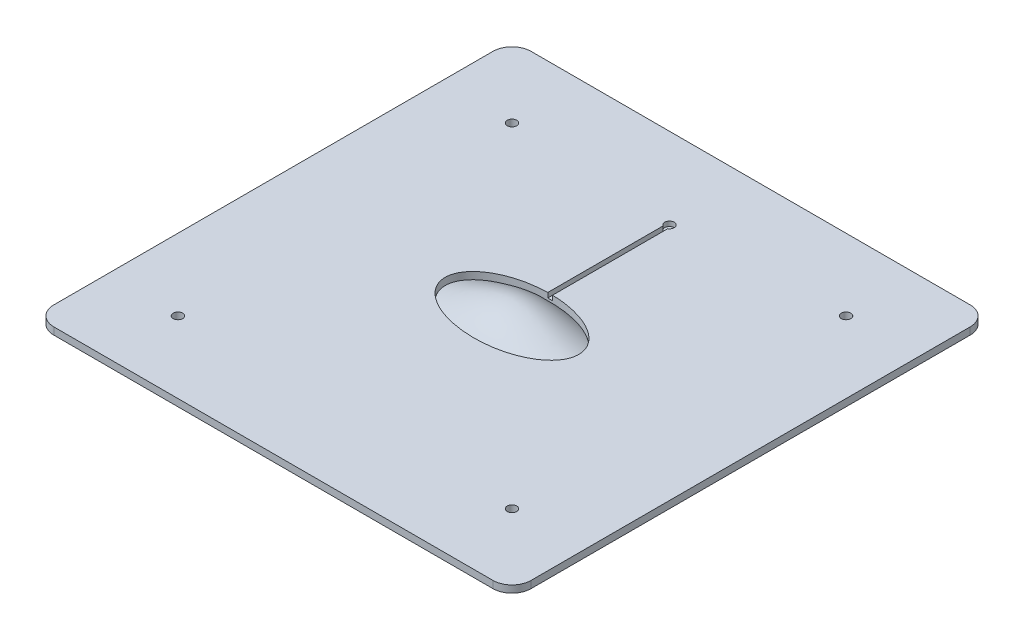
SolidWorks part; units mm, degrees
ref_plane "前视基准面" through (0, 0, 0) normal (0, 0, 1) x (1, 0, 0)
ref_plane "上视基准面" through (0, 0, 0) normal (0, 1, 0) x (1, 0, 0)
ref_plane "右视基准面" through (0, 0, 0) normal (1, 0, 0) x (0, 0, -1)
other "Configuration Table"
sketch "草图1" plane through (0, 0, 0) normal (0, 1, 0) x (1, 0, 0)
  line L1 (46, -50) -> (-46, -50)
  line L2 (50, -46) -> (50, 46)
  line L3 (46, 50) -> (-46, 50)
  line L4 (-50, -46) -> (-50, 46)
  line L5 (50, -50) -> (-50, 50) construction
  line L6 (50, 50) -> (-50, -50) construction
  arc A0 (-46, -50) -> (-50, -46) centre (-46, -46) cw
  arc A1 (46, -50) -> (50, -46) centre (46, -46) ccw
  arc A2 (46, 50) -> (50, 46) centre (46, 46) cw
  arc A3 (-50, 46) -> (-46, 50) centre (-46, 46) cw
  point P0 (0, 0)
  dimension "D3" = 4
  dimension "D1" = 100
  dimension "D2" = 100
extrude "凸台-拉伸1" add sketch "草图1" along normal blind 1.5
sketch "草图2" plane through (0, 1.5, 0) normal (0, 1, 0) x (1, 0, 0)
  ellipse E0 centre (0, 0) end of major axis (-14, 0) minor radius 8
  dimension "D1" = 28
  dimension "D2" = 16
extrude "切除-拉伸2" cut sketch "草图2" against normal blind 10
sketch "草图4" plane through (0, 0, 0) normal (0, -1, 0) x (1, 0, 0)
  line L0 (-14, 0) -> (14, 0) construction
  ellipse E0 centre (0, 0) end of major axis (-14, 0) minor radius 8 construction
  ellipse E1 centre (0, 0) end of major axis (-14, 0) minor radius 8 (14, 0) -> (-14, 0) ccw
  point P0 (-14, 0)
  point P1 (14, 0)
  point P9 (-14, 0)
  point P15 (14, 0)
sketch "草图5" plane through (0, 0, 0) normal (0, -1, 0) x (1, 0, 0)
  line L0 (-14, 0) -> (14, 0) construction
  line L1 (-14, 0) -> (14, 0) construction
  ellipse E0 centre (0, 0) end of major axis (-14, 0) minor radius 8 (-14, 0) -> (14, 0) ccw
sketch "草图6" plane through (0, 0, 0) normal (1, 0, 0) x (0, 0, -1)
  line L0 (-8, 0) -> (0, 0) construction
  spline S0 degree 2 poles (-8, 0) (0, 8.7188) (8, 0) knots 0 0 0 1 1 1
  point P2 (0, 4.3594)
surface "曲面-放样1"
sketch "草图7" plane through (0, 1.5, 0) normal (0, 1, 0) x (1, 0, 0)
  line L0 (0, 11.2203) -> (0, 33)
  line L1 (-6.6765, 11.2203) -> (9.1079, 11.2203) construction
  line L2 (46, 50) -> (-46, 50) construction
  dimension "D1" = 17
extrude "切除-拉伸-薄壁2" cut sketch "草图7" against normal blind 1 thin
sketch "草图9" plane through (0, 1.5, 0) normal (0, 1, 0) x (1, 0, 0)
  line L0 (-0.5, 11.2203) -> (0.5, 11.2203)
  line L1 (-0.5, 11.2203) -> (-0.5, 6.7293)
  line L2 (0.5, 11.2203) -> (0.5, 6.7293)
  line L3 (-0.5, 6.7293) -> (0.5, 6.7293)
  line L4 (-0.5, 11.2203) -> (-0.5, 33) construction
extrude "切除-拉伸3" cut sketch "草图9" against normal blind 1
sketch "草图10" plane through (0, 1.5, 0) normal (0, 1, 0) x (1, 0, 0)
  line L0 (-0.5, 33) -> (0.5, 33) construction
  line L1 (46, 50) -> (-46, 50) construction
  line L2 (-50, 46) -> (-50, -46) construction
  circle A0 centre (0, 33) radius 1
  circle A1 centre (-35, 35) radius 1
  circle A2 centre (35, 35) radius 1
  circle A3 centre (35, -35) radius 1
  circle A4 centre (-35, -35) radius 1
  point P4 (-35, 35)
  point P12 (35, 35)
  point P13 (35, -35)
  point P14 (-35, -35)
  point P15 (0, 0)
  point P24 (0, 0)
  dimension "D1" = 15
  dimension "D4" = 4
  dimension "D2" = 15
  dimension "D3" = 4
extrude "切除-拉伸4" cut sketch "草图10" against normal through all contours A1 | A4 | A3 | A2
sketch "草图11" plane through (0, 1.5, 0) normal (0, 1, 0) x (1, 0, 0)
  line L0 (-0.5, 33) -> (0.5, 33) construction
  circle A0 centre (0, 33) radius 1
extrude "切除-拉伸5" cut sketch "草图11" against normal blind 1
sketch "草图12" plane through (0, 0.5, 0) normal (0, 1, 0) x (1, 0, 0)
  circle A0 centre (0, 33) radius 1
